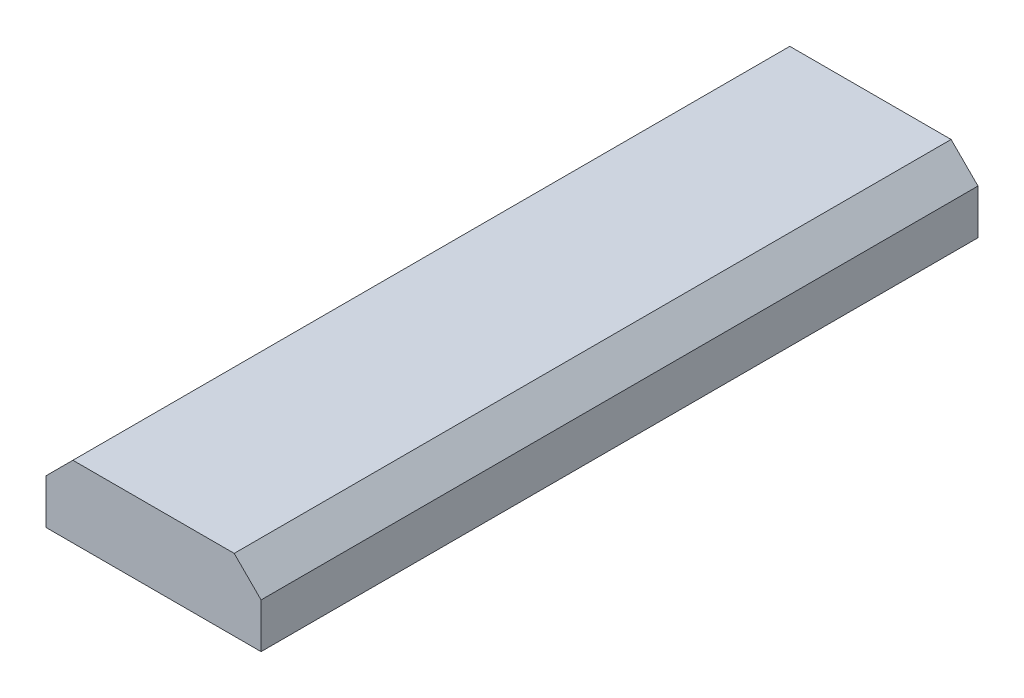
SolidWorks part; units mm, degrees
ref_plane "Front" through (0, 0, 0) normal (0, 0, 1) x (1, 0, 0)
ref_plane "Top" through (0, 0, 0) normal (0, 1, 0) x (1, 0, 0)
ref_plane "Right" through (0, 0, 0) normal (1, 0, 0) x (0, 0, -1)
sketch "Sketch1" plane through (0, 0, 0) normal (0, 0, 1) x (1, 0, 0)
  line L0 (-38.1, 15.875) -> (-28.575, 25.4)
  line L1 (-38.1, 0) -> (38.1, 0)
  line L2 (-38.1, 0) -> (-38.1, 15.875)
  line L3 (-28.575, 25.4) -> (28.575, 25.4)
  line L4 (38.1, 0) -> (38.1, 15.875)
  line L5 (28.575, 25.4) -> (38.1, 15.875)
  point P1 (38.1, 25.4)
  point P2 (-38.1, 25.4)
  dimension "D1" = 76.2
  dimension "D2" = 25.4
  dimension "D5" = 9.525
  dimension "D6" = 9.525
extrude "Base-Extrude" add sketch "Sketch1" against normal blind 254
sketch "Sketch2" plane through (0, 0, 0) normal (0, -1, 0) x (1, 0, 0)
  line L3 (-38.1, -254) -> (38.1, -254) construction
  circle A0 centre (0, -203.2) radius 7.874
  dimension "D1" = 15.748
  dimension "D2" = 50.8
extrude "Boss-Extrude1" add sketch "Sketch2" along normal blind 9.525
